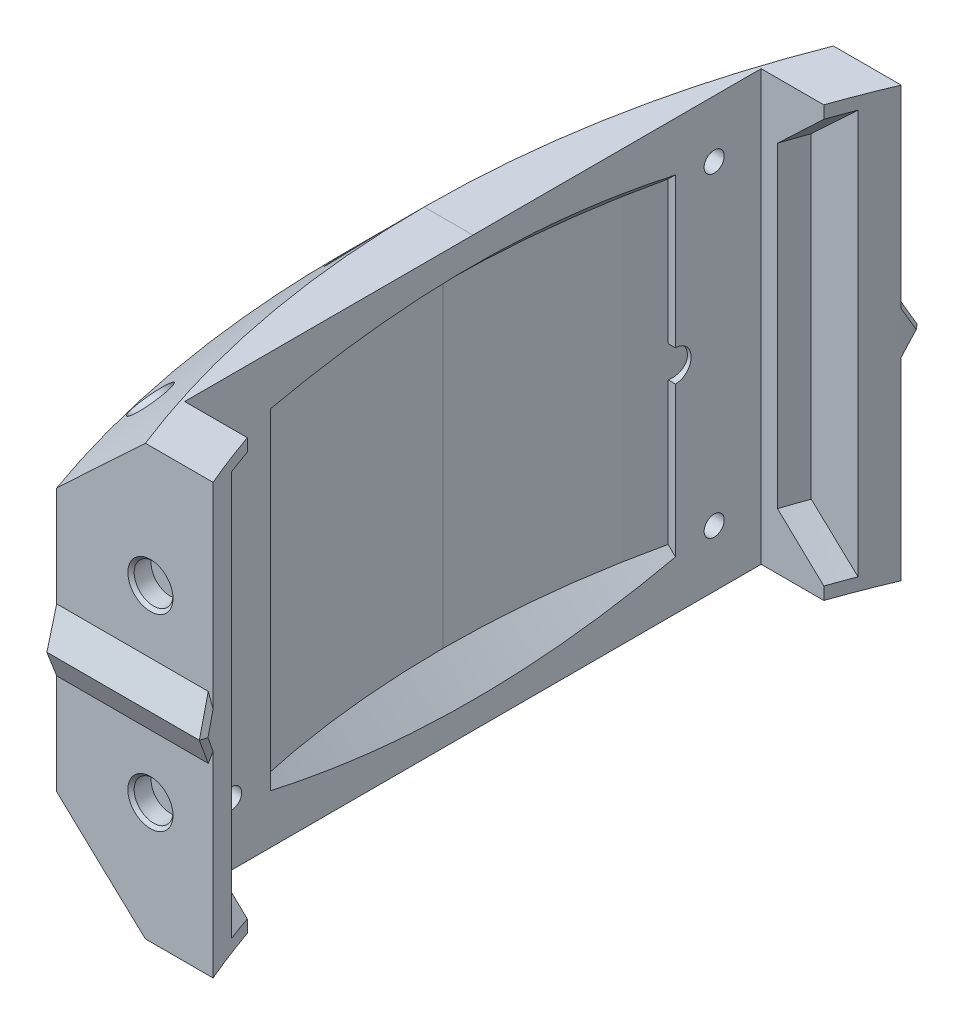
SolidWorks part; units mm, degrees
ref_plane "Front Plane" through (0, 0, 0) normal (0, 0, 1) x (1, 0, 0)
ref_plane "Top Plane" through (0, 0, 0) normal (0, 1, 0) x (1, 0, 0)
ref_plane "Right Plane" through (0, 0, 0) normal (1, 0, 0) x (0, 0, -1)
body saved out of another part "Stock-Frame Circ-1"
other "Move Face1" parameters "D1"=0.1
other "Move Face2" parameters "D1"=0.1
ref_plane "Plane1" through (0, -34.25, 0) normal (0, 1, 0) x (1, 0, 0)
sketch "Sketch4" plane through (0, 0, 0) normal (0, 1, 0) x (1, 0, 0)
  line L0 (-157.9822, 8.5) -> (-157.9822, -8.5)
  line L1 (-150, 0) -> (-163.25, 0) construction
  arc A0 (-157.9822, 8.5) -> (-157.9822, -8.5) centre (-163.25, 0) cw
  point P3 (-157.9822, 0)
  dimension "D2" = 10
  dimension "D1" = 17
extrude "Cut-Extrude2" cut sketch "Sketch4" against normal blind 9
mirror "Mirror1" about plane through (0, -34.25, 0) normal (0, 1, 0) of "Cut-Extrude2"
chamfer "Chamfer1" distance 1 angle 45 4 edges at (-157.9822, -9, 0) (-153.25, -9, 0) (-157.9822, -59.5, 0) (-153.25, -59.5, 0)
chamfer "Chamfer2" distance 1 4 edges at (-154.4903, -4.5661, 4.8236) (-153.8365, -3.8738, -3.3743) (-154.4903, -63.9339, 4.8236) (-153.8365, -64.6262, -3.3743)
sketch "Sketch5" plane through (0, 0, 54.9) normal (0, 0, 1) x (1, 0, 0)
  line L0 (-128.7866, -29.2736) -> (-128.7866, 0) construction
  line L1 (-152.8304, -34.25) -> (-127.6973, -34.25) construction
  circle A0 centre (-138.7866, -19.25) radius 3.1
  dimension "D1" = 6.2
  dimension "D2" = 10
  dimension "D3" = 15
extrude "Cut-Extrude3" cut sketch "Sketch5" against normal blind 3.2
mirror "Mirror2" about plane through (0, 0, 0) normal (0, 0, 1) of "Cut-Extrude3"
chamfer "Chamfer3" distance 0.5 angle 45 4 edges at (-135.6866, -19.25, 54.9) (-135.6866, -49.25, 54.9) (-135.6866, -19.25, -54.9) (-135.6866, -49.25, -54.9)
sketch "Sketch6" plane through (-142.2271, 0, 0) normal (1, 0, 0) x (0, 0, -1)
  line L0 (19.554, -34.25) -> (-19.554, -34.25) construction
  line L1 (32.3273, -60.6453) -> (32.3273, -7.8547) construction
  circle A0 centre (32.3273, -34.25) radius 2.5
  dimension "D1" = 5
extrude "Cut-Extrude4" cut sketch "Sketch6" against normal up to surface (0.5877 mm away)
chamfer "Chamfer4" distance 1 angle 45 4 edges at (-128.248, -31.7671, -56.1467) (-128.248, -36.7329, -56.1467) (-128.248, -31.7671, 56.1467) (-128.248, -36.7329, 56.1467)
